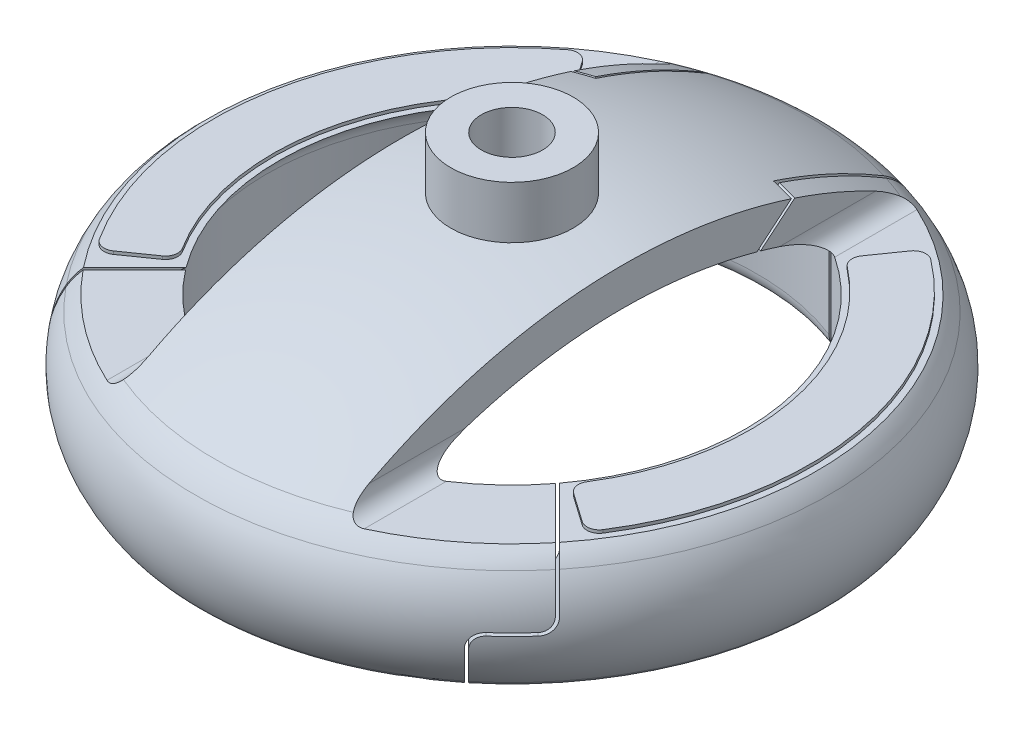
SolidWorks part; units mm, degrees
ref_plane "Спереди" through (0, 0, 0) normal (0, 0, 1) x (1, 0, 0)
ref_plane "Сверху" through (0, 0, 0) normal (0, 1, 0) x (1, 0, 0)
ref_plane "Справа" through (0, 0, 0) normal (1, 0, 0) x (0, 0, -1)
sketch "Эскиз1" plane through (0, 0, 0) normal (0, 0, 1) x (1, 0, 0)
  line L0 (0, 511.4051) -> (0, -258.6679) construction
  line L1 (-145.073, 0) -> (648.7226, 0) construction
  line L2 (500, 361.7701) -> (500, -192.062) construction
  line L3 (0, 350) -> (-290.5746, 350) construction
  line L4 (485.6645, 0) -> (430, 0)
  line L5 (400, 30) -> (400, 171.5772)
  line L6 (0, 330) -> (50, 330)
  line L7 (50, 330) -> (50, 430)
  line L8 (50, 430) -> (100, 430)
  line L9 (100, 430) -> (100, 344.4786)
  line L10 (0, 330) -> (0, 290)
  arc A0 (510.0315, 12.5) -> (517.5593, 175.9295) centre (388.1966, 100) ccw
  arc A1 (500, 200) -> (0, 350) centre (0, -558.3333) ccw construction
  arc A2 (0, 290) -> (383.5642, 198.3357) centre (0, -558.3333) cw
  arc A3 (484.6764, 209.8843) -> (100, 344.4786) centre (0, -558.3333) ccw
  arc A4 (400, 171.5772) -> (383.5642, 198.3357) centre (370, 171.5772) ccw
  arc A5 (484.6764, 209.8843) -> (517.5593, 175.9295) centre (431.3175, 125.3098) cw
  arc A6 (485.6645, 0) -> (510.0315, 12.5) centre (485.6645, 30) ccw
  arc A7 (400, 30) -> (430, 0) centre (430, 30) ccw
  point P30 (500, 0)
  point P33 (400, 0)
  dimension "D3" = 350
  dimension "D4" = 150
  dimension "D11" = 30
  dimension "D12" = 100
  dimension "D13" = 30
  dimension "D14" = 30
  dimension "D1" = 500
  dimension "D2" = 200
  dimension "D5" = 60
  dimension "D6" = 100
  dimension "D7" = 80
  dimension "D8" = 100
  dimension "D9" = 100
  dimension "D10" = 50
revolve "Повернуть1" add sketch "Эскиз1" angle 360 about L0
sketch "Эскиз2" plane through (0, 0, 0) normal (0, 0, 1) x (1, 0, 0)
  line L0 (0, 536.4266) -> (0, -81.0812) construction
  line L1 (-625.9563, 0) -> (666.6626, 0) construction
  line L2 (180, 350) -> (530, 350)
  line L3 (180, 350) -> (180, 230)
  line L4 (210, 200) -> (530, 200)
  line L5 (530, 350) -> (530, 200)
  line L6 (-180, 350) -> (-530, 350)
  line L7 (-530, 350) -> (-530, 200)
  line L8 (-210, 200) -> (-530, 200)
  line L9 (-180, 350) -> (-180, 230)
  arc A0 (210, 200) -> (180, 230) centre (210, 230) cw
  arc A1 (-210, 200) -> (-180, 230) centre (-210, 230) ccw
  dimension "D5" = 30
  dimension "D1" = 180
  dimension "D2" = 200
  dimension "D3" = 350
  dimension "D4" = 150
extrude "Вырез-Вытянуть1" cut sketch "Эскиз2" against normal mid plane 1000
sketch "Эскиз3" plane through (-180, 0, 0) normal (-1, 0, 0) x (0, 0, 1)
  line L0 (0, 494.1842) -> (0, -64.1842) construction
  line L1 (-206.9387, 230) -> (-326.114, 330)
  line L2 (-206.9387, 230) -> (-214.7173, 230)
  line L3 (-326.114, 330) -> (-333.8926, 330)
  line L4 (-214.7173, 230) -> (-333.8926, 330)
  line L5 (-559.1364, 0) -> (558.3684, 0) construction
  arc A0 (256.5151, 230) -> (-256.5151, 230) centre (0, -558.3333) ccw construction
  point P9 (-220, 240.9598)
  dimension "D1" = 40
  dimension "D2" = 5
  dimension "D3" = 230
  dimension "D4" = 100
  dimension "D5" = 220
extrude "Вырез-Вытянуть2" cut sketch "Эскиз3" against normal blind 30
sketch "Эскиз4" plane through (-150, 0, 0) normal (-1, 0, 0) x (0, 0, 1)
  line L0 (0, 478.0552) -> (0, -86.4575) construction
  line L1 (524.9621, 0) -> (-567.0444, 0) construction
  line L3 (-200, 224.1778) -> (-200, 0)
  line L4 (-276.1516, 288.0766) -> (-220, 240.9598)
  line L5 (-314.1965, 320) -> (-200, 224.1778)
  line L6 (-200, 0) -> (-550, 0)
  line L7 (-550, 0) -> (-550, 320)
  line L8 (-550, 320) -> (-314.1965, 320)
  dimension "D2" = 200
  dimension "D3" = 350
  dimension "D4" = 320
  dimension "D1" = 0
extrude "Вырез-Вытянуть3" cut sketch "Эскиз4" against normal blind 5
ref_plane "Плоскость1" through (0, 0, 0) normal (1, 0, 0) x (0, 0, -1)
mirror "Зеркальное отражение1" about plane through (0, 0, 0) normal (1, 0, 0) of "Вырез-Вытянуть3", "Вырез-Вытянуть2"
sketch "Эскиз5" plane through (0, 200, 0) normal (0, 1, 0) x (1, 0, 0)
  line L0 (0, 566.0488) -> (0, -595.867) construction
  line L1 (-580.4609, 0) -> (661.964, 0) construction
  line L2 (0, 0) -> (-510.2518, -357.2822) construction
  line L3 (0, 0) -> (-402.4035, 574.6917) construction
  line L4 (-235.0374, 335.6683) -> (-268.08, 382.8579)
  line L5 (-335.6683, -235.0374) -> (-382.8579, -268.08)
  line L6 (335.6683, -235.0374) -> (382.8579, -268.08)
  line L7 (235.0374, 335.6683) -> (268.08, 382.8579)
  line L8 (0, 0) -> (-424.2641, -424.2641) construction
  line L9 (0, 0) -> (424.2641, -424.2641) construction
  arc A0 (-330.217, -207.9952) -> (-239.1639, 308.3924) centre (0, 0) cw
  arc A1 (-411.188, -262.4576) -> (-296.6245, 387.264) centre (0, 0) cw
  arc A2 (-210, 317.0173) -> (-210, -317.0173) centre (0, 0) ccw construction
  arc A3 (-210, 451.3488) -> (-210, -451.3488) centre (0, 0) ccw construction
  arc A4 (-296.6245, 387.264) -> (-268.08, 382.8579) centre (-284.4631, 371.3864) cw
  arc A5 (-235.0374, 335.6683) -> (-239.1639, 308.3924) centre (-251.4205, 324.1967) cw
  arc A6 (-411.188, -262.4576) -> (-382.8579, -268.08) centre (-394.3295, -251.697) ccw
  arc A7 (-335.6683, -235.0374) -> (-330.217, -207.9952) centre (-347.1398, -218.6544) ccw
  arc A8 (411.188, -262.4576) -> (382.8579, -268.08) centre (394.3295, -251.697) cw
  arc A9 (335.6683, -235.0374) -> (330.217, -207.9952) centre (347.1398, -218.6544) cw
  arc A10 (330.217, -207.9952) -> (239.1639, 308.3924) centre (0, 0) ccw
  arc A11 (411.188, -262.4576) -> (296.6245, 387.264) centre (0, 0) ccw
  arc A12 (296.6245, 387.264) -> (268.08, 382.8579) centre (284.4631, 371.3864) ccw
  arc A13 (235.0374, 335.6683) -> (239.1639, 308.3924) centre (251.4205, 324.1967) ccw
  point P20 (-279.7969, 399.5913)
  point P23 (-223.8457, 319.6848)
  point P26 (-399.5913, -279.7969)
  point P29 (-319.6848, -223.8457)
  dimension "D3" = 10
  dimension "D4" = 10
  dimension "D5" = 20
  dimension "D1" = 35
  dimension "D2" = 55
  dimension "D6" = 10
  dimension "D7" = 600
extrude "Бобышка-Вытянуть1" add sketch "Эскиз5" along normal blind 5
ref_plane "Плоскость2" through (-424.2641, 200, 424.2641) normal (-0.7071, 0, 0.7071) x (0.7071, 0, 0.7071)
sketch "Эскиз6" plane through (-424.2641, 200, 424.2641) normal (-0.7071, 0, 0.7071) x (0.7071, 0, 0.7071)
  line L0 (0, 404.8402) -> (0, -459.1407) construction
  line L1 (540.2591, -200) -> (-658.0968, -200) construction
  line L2 (573.3964, -100) -> (-629.0171, -100) construction
  line L3 (50, -200) -> (50, -122.5)
  line L5 (-55, -77.5) -> (-55, 0)
  line L6 (380.5735, 0) -> (-48.9519, 0) construction
  line L7 (-55, 0) -> (-50, 0)
  line L8 (170.6594, 0) -> (-497.811, 0) construction
  line L9 (-50, 0) -> (-50, -77.5)
  line L10 (-30, -97.5) -> (30, -97.5)
  line L11 (55, -122.5) -> (55, -200)
  line L12 (55, -200) -> (50, -200)
  line L13 (-30, -102.5) -> (30, -102.5)
  arc A0 (-50, -77.5) -> (-30, -97.5) centre (-30, -77.5) ccw
  arc A1 (30, -102.5) -> (50, -122.5) centre (30, -122.5) cw
  arc A2 (30, -97.5) -> (55, -122.5) centre (30, -122.5) cw
  arc A3 (-55, -77.5) -> (-30, -102.5) centre (-30, -77.5) ccw
  dimension "D8" = 20
  dimension "D9" = 25
  dimension "D1" = 100
  dimension "D2" = 50
  dimension "D3" = 5
  dimension "D4" = 50
  dimension "D5" = 5
  dimension "D6" = 2.5
  dimension "D7" = 2.5
extrude "Вырез-Вытянуть4" cut sketch "Эскиз6" against normal blind 300
ref_plane "Плоскость3" through (424.2641, 200, 424.2641) normal (0.7071, 0, 0.7071) x (0.7071, 0, -0.7071)
sketch "Эскиз7" plane through (424.2641, 200, 424.2641) normal (0.7071, 0, 0.7071) x (0.7071, 0, -0.7071)
  line L0 (0, 467.5874) -> (0, -448.2806) construction
  line L1 (-635.9189, -200) -> (682.9793, -200) construction
  line L2 (-586.4579, -100) -> (299.4607, -100) construction
  line L3 (-55, -200) -> (-55, -122.5)
  line L4 (-30, -97.5) -> (30, -97.5)
  line L5 (50, -77.5) -> (50, 0)
  line L6 (497.811, 0) -> (-170.6594, 0) construction
  line L7 (50, 0) -> (55, 0)
  line L8 (55, 0) -> (55, -77.5)
  line L9 (30, -102.5) -> (-30, -102.5)
  line L10 (-50, -122.5) -> (-50, -200)
  line L11 (-50, -200) -> (-55, -200)
  arc A0 (-50, -122.5) -> (-30, -102.5) centre (-30, -122.5) cw
  arc A1 (30, -97.5) -> (50, -77.5) centre (30, -77.5) ccw
  arc A2 (55, -77.5) -> (30, -102.5) centre (30, -77.5) cw
  arc A3 (-55, -122.5) -> (-30, -97.5) centre (-30, -122.5) cw
  dimension "D8" = 20
  dimension "D9" = 25
  dimension "D1" = 100
  dimension "D2" = 50
  dimension "D3" = 50
  dimension "D4" = 5
  dimension "D5" = 5
  dimension "D6" = 2.5
  dimension "D7" = 2.5
extrude "Вырез-Вытянуть5" cut sketch "Эскиз7" against normal blind 300
ref_plane "Плоскость4" through (600, 0, 0) normal (1, 0, 0) x (0, 0, -1)
split "Разделить1" trim tools "Плоскость4" bodies to split 112 110 113 resulting bodies 116 117 118
